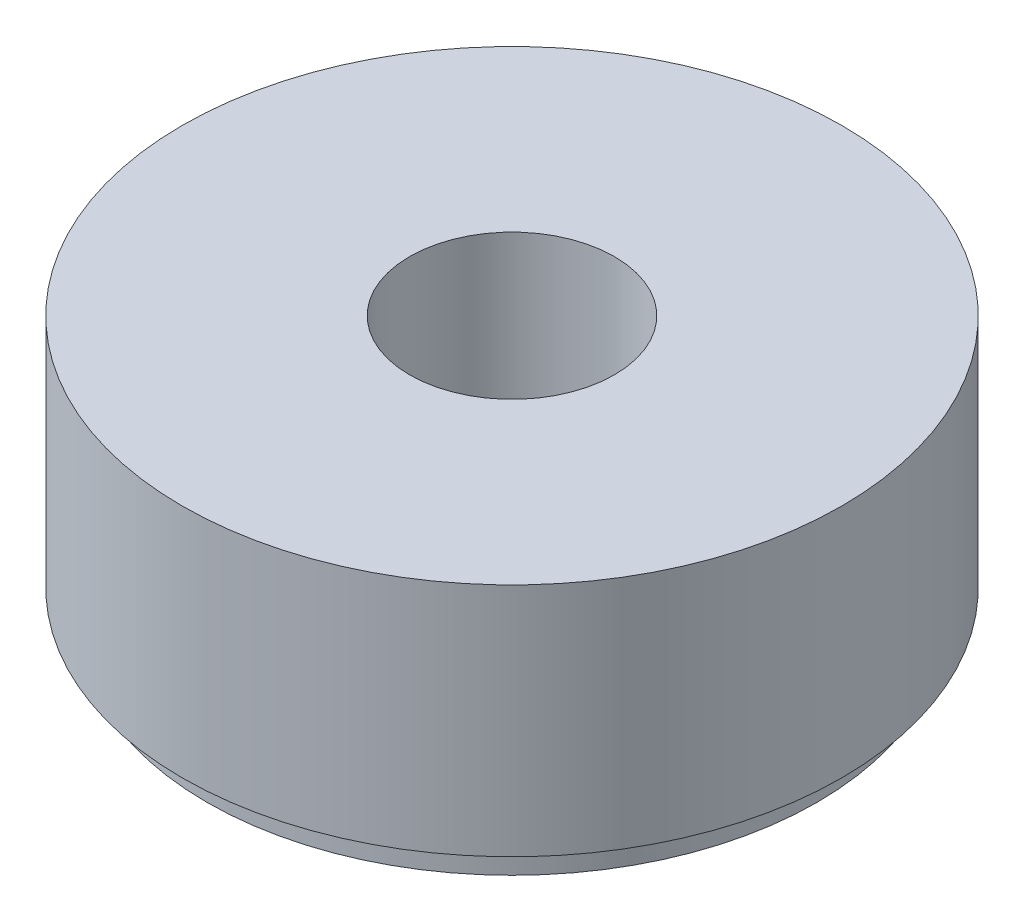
SolidWorks part; units mm, degrees
ref_plane "Front Plane" through (0, 0, 0) normal (0, 0, 1) x (1, 0, 0)
ref_plane "Top Plane" through (0, 0, 0) normal (0, 1, 0) x (1, 0, 0)
ref_plane "Right Plane" through (0, 0, 0) normal (1, 0, 0) x (0, 0, -1)
sketch "Sketch1" plane through (0, 0, 0) normal (0, 1, 0) x (1, 0, 0)
  circle A0 centre (0, 0) radius 14.49
  dimension "D1" = 28.98
extrude "Boss-Extrude1" add sketch "Sketch1" along normal blind 2
sketch "Sketch2" plane through (0, 2, 0) normal (0, 1, 0) x (1, 0, 0)
  circle A0 centre (0, 0) radius 18.26
  dimension "D1" = 36.52
extrude "Boss-Extrude2" add sketch "Sketch2" along normal blind 2
sketch "Sketch3" plane through (0, 4, 0) normal (0, 1, 0) x (1, 0, 0)
  circle A0 centre (0, 0) radius 19.73
  dimension "D1" = 39.46
extrude "Boss-Extrude3" add sketch "Sketch3" along normal blind 14.09
sketch "Sketch4" plane through (0, 0, 0) normal (0, -1, 0) x (1, 0, 0)
  circle A0 centre (0, 0) radius 6.13
  dimension "D1" = 12.26
extrude "Cut-Extrude1" cut sketch "Sketch4" against normal up to next
